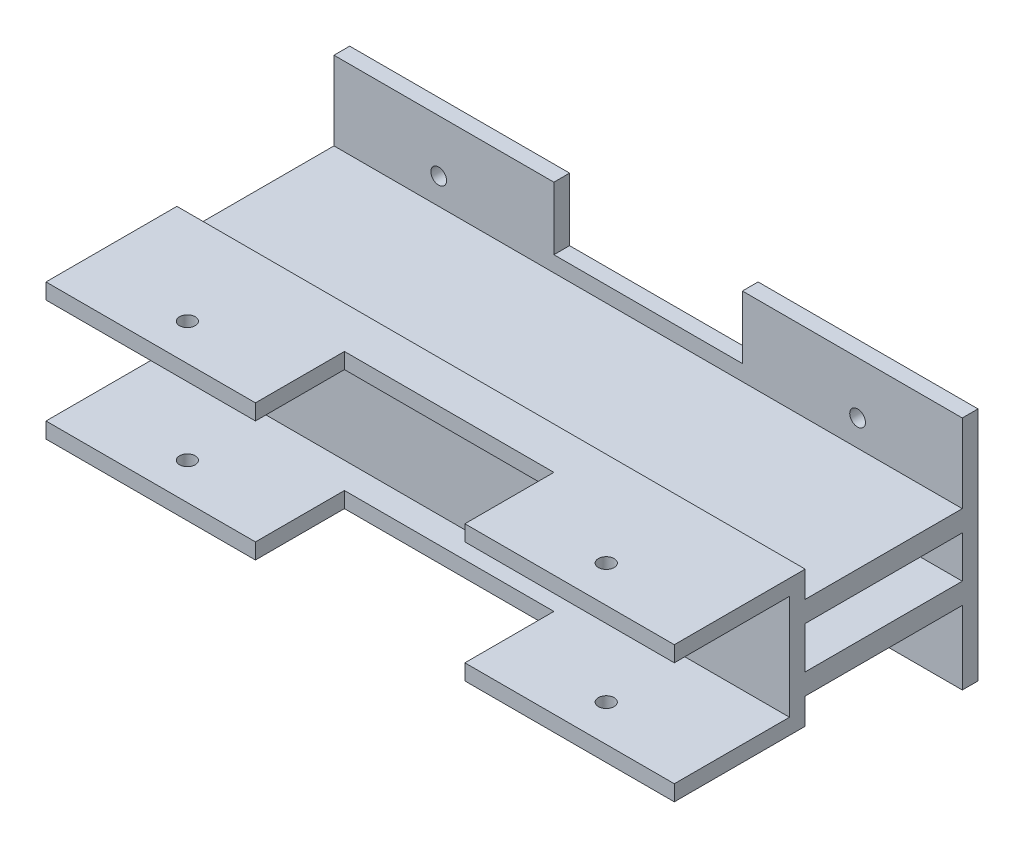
SolidWorks part; units mm, degrees
ref_plane "前视基准面" through (0, 0, 0) normal (0, 0, 1) x (1, 0, 0)
ref_plane "上视基准面" through (0, 0, 0) normal (0, 1, 0) x (1, 0, 0)
ref_plane "右视基准面" through (0, 0, 0) normal (1, 0, 0) x (0, 0, -1)
other "Configuration Table"
sketch "草图1" plane through (0, 0, 0) normal (0, 1, 0) x (1, 0, 0)
  line L1 (-100, -12.5) -> (100, -12.5)
  line L2 (-100, -12.5) -> (-100, 12.5)
  line L3 (-100, 12.5) -> (100, 12.5)
  line L4 (100, -12.5) -> (100, 12.5)
  line L5 (-100, -12.5) -> (100, 12.5) construction
  line L6 (-100, 12.5) -> (100, -12.5) construction
  point P0 (0, 0)
  dimension "D1" = 200
extrude "凸台-拉伸1" add sketch "草图1" along normal blind 3
sketch "草图2" plane through (0, 0, 0) normal (0, -1, 0) x (1, 0, 0)
  line L0 (100, 12.5) -> (100, -12.5) construction
  line L1 (-100, -12.5) -> (100, -12.5)
  line L2 (-100, -12.5) -> (-100, -9.5)
  line L3 (-100, -9.5) -> (100, -9.5)
  line L4 (100, -12.5) -> (100, -9.5)
extrude "凸台-拉伸2" add sketch "草图2" along normal blind 20
sketch "草图3" plane through (0, -20, 0) normal (0, -1, 0) x (1, 0, 0)
  line L1 (-100, 12.5) -> (100, 12.5)
  line L2 (-100, 12.5) -> (-100, -12.5)
  line L3 (-100, -12.5) -> (100, -12.5)
  line L4 (100, 12.5) -> (100, -12.5)
extrude "凸台-拉伸4" add sketch "草图3" along normal blind 3
sketch "草图4" plane through (0, 3, 0) normal (0, 1, 0) x (1, 0, 0)
  circle A0 centre (-80, -5.5) radius 1.5
  circle A1 centre (-40, -5.5) radius 1.5
  circle A2 centre (0, -5.5) radius 1.5
  circle A3 centre (40, -5.5) radius 1.5
  circle A4 centre (80, -5.5) radius 1.5
  dimension "D1" = 5
extrude "切除-拉伸1" cut sketch "草图4" against normal up to surface (26 mm away)
sketch "草图5" plane through (0, 0, -12.5) normal (0, 0, -1) x (-1, 0, 0)
  line L0 (-100, -2) -> (-100, -6)
  line L1 (-100, 3) -> (-100, -23) construction
  line L2 (-100, -18) -> (-100, -14)
  line L3 (-100, -6) -> (100, -6)
  line L4 (100, 3) -> (100, -23) construction
  line L5 (-100, -14) -> (100, -14)
  line L6 (-100, -2) -> (100, -2)
  line L8 (-100, -18) -> (100, -18)
  line L9 (100, -2) -> (100, -6)
  line L10 (100, -14) -> (100, -18)
extrude "凸台-拉伸5" add sketch "草图5" along normal blind 30
sketch "草图6" plane through (0, 0, -42.5) normal (0, 0, -1) x (-1, 0, 0)
  line L2 (-100, 3) -> (100, 3) construction
  line L3 (-100, -32) -> (100, -32)
  line L9 (-100, -32) -> (-100, 13)
  line L10 (-100, 13) -> (100, 13)
  line L11 (100, -32) -> (100, 13)
  line L12 (100, -23) -> (-100, -23) construction
  circle A0 centre (-80, 3) radius 1.5
  circle A1 centre (-80, -23) radius 1.5
  circle A2 centre (-40, 3) radius 1.5
  circle A3 centre (-40, -23) radius 1.5
  circle A4 centre (0, 3) radius 1.5
  circle A5 centre (0, -23) radius 1.5
  circle A6 centre (40, 3) radius 1.5
  circle A7 centre (40, -23) radius 1.5
  circle A8 centre (80, 3) radius 1.5
  circle A9 centre (80, -23) radius 1.5
  dimension "D1" = 5
extrude "凸台-拉伸6" add sketch "草图6" along normal blind 3
sketch "草图7" plane through (0, 3, 0) normal (0, 1, 0) x (1, 0, 0)
  line L0 (-60, 4.5) -> (-60, -12.5)
  line L2 (0, -55) -> (0, 55) construction
  line L3 (20, 4.5) -> (20, -12.5)
  line L4 (60, 4.5) -> (20, 4.5)
  line L5 (-100, -12.5) -> (100, -12.5) construction
  line L6 (-60, 4.5) -> (-20, 4.5)
  line L7 (-20, 4.5) -> (-20, -12.5)
  line L8 (60, 4.5) -> (60, -12.5)
  line L9 (-60, -12.5) -> (-20, -12.5)
  line L10 (20, -12.5) -> (60, -12.5)
extrude "切除-拉伸2" cut sketch "草图7" against normal up to surface (26 mm away)
sketch "草图9" plane through (0, 0, -45.5) normal (0, 0, -1) x (-1, 0, 0)
  line L1 (-100, -32) -> (100, -32) construction
  line L2 (22, 1) -> (58, 1)
  line L3 (22, -20) -> (22, -32)
  line L4 (40, -20) -> (22, -20)
  line L5 (40, -20) -> (58, -20)
  line L9 (22, -32) -> (58, -32)
  line L10 (58, -32) -> (58, -20)
  line L11 (40, 13) -> (22, 13)
  line L12 (58, 1) -> (58, 13)
  line L13 (22, 13) -> (22, 1)
  line L14 (40, 13) -> (58, 13)
extrude "切除-拉伸3" cut sketch "草图9" against normal blind 10
ref_plane "基准面5" through (20, 0, 0) normal (1, 0, 0) x (0, 0, -1)
sketch "草图10" plane through (20, 0, 0) normal (1, 0, 0) x (0, 0, -1)
  line L1 (-17.4181, 13.9581) -> (47.8565, 13.9581)
  line L2 (-17.4181, 13.9581) -> (-17.4181, -33.7645)
  line L3 (-17.4181, -33.7645) -> (47.8565, -33.7645)
  line L4 (47.8565, 13.9581) -> (47.8565, -33.7645)
  line L5 (-17.4181, 13.9581) -> (47.8565, -33.7645) construction
  line L6 (-17.4181, -33.7645) -> (47.8565, 13.9581) construction
  point P0 (15.2192, -9.9032)
extrude "切除-拉伸4" cut sketch "草图10" along normal blind 90
